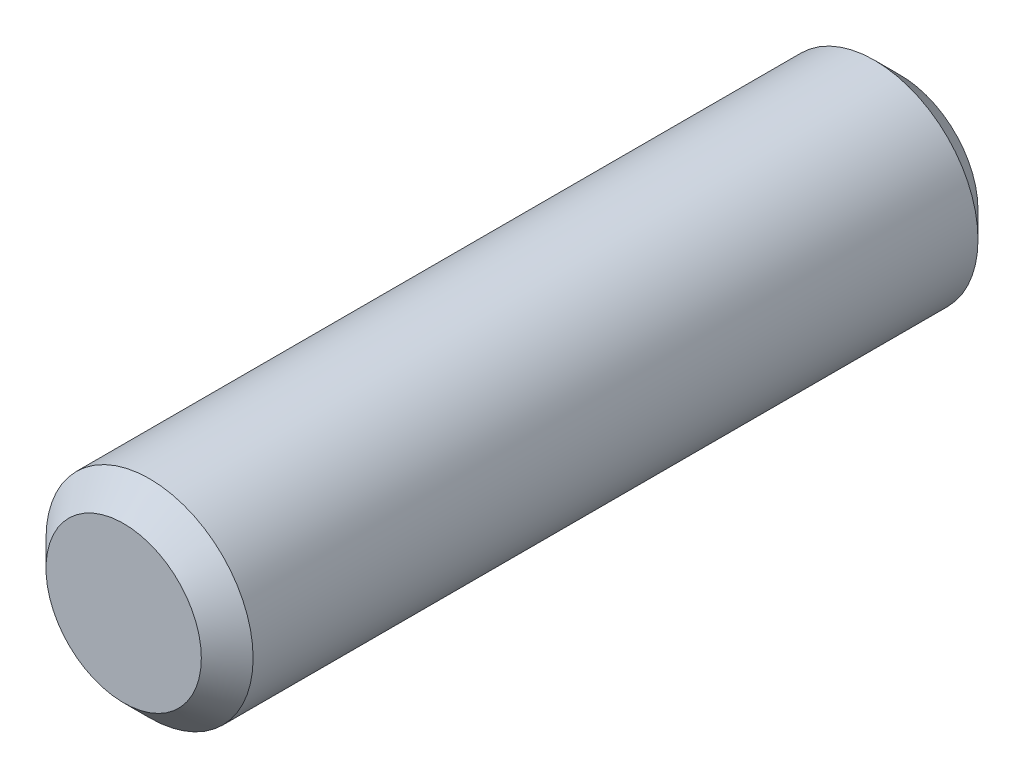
SolidWorks part; units mm, degrees
ref_plane "Plan de face" through (0, 0, 0) normal (0, 0, 1) x (1, 0, 0)
ref_plane "Plan de dessus" through (0, 0, 0) normal (0, 1, 0) x (1, 0, 0)
ref_plane "Plan de droite" through (0, 0, 0) normal (1, 0, 0) x (0, 0, -1)
sketch "Esquisse1" plane through (0, 0, 0) normal (0, 0, 1) x (1, 0, 0)
  circle A0 centre (0, 0) radius 2
extrude "Boss.-Extru.1" add sketch "Esquisse1" along normal blind 15
chamfer "Chanfrein2" distance 0.5 angle 45 2 edges at (2, 0, 0) (2, 0, 15)
